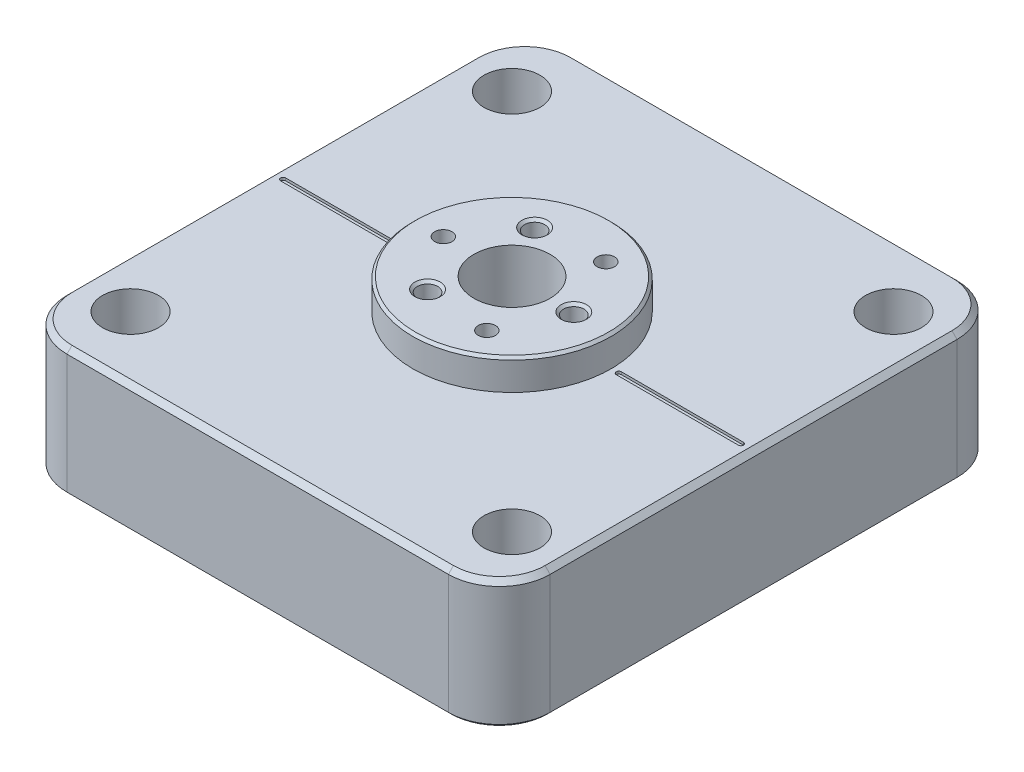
SolidWorks part; units mm, degrees
ref_plane "前视基准面" through (0, 0, 0) normal (0, 0, 1) x (1, 0, 0)
ref_plane "上视基准面" through (0, 0, 0) normal (0, 1, 0) x (1, 0, 0)
ref_plane "右视基准面" through (0, 0, 0) normal (1, 0, 0) x (0, 0, -1)
sketch "Sketch1" plane through (0, 0, 0) normal (0, 1, 0) x (1, 0, 0)
  line L1 (-47.5, -50) -> (47.5, -50)
  line L2 (-47.5, -50) -> (-47.5, 50)
  line L3 (-47.5, 50) -> (47.5, 50)
  line L4 (47.5, -50) -> (47.5, 50)
  line L5 (-47.5, -50) -> (47.5, 50) construction
  line L6 (-47.5, 50) -> (47.5, -50) construction
  point P0 (0, 0)
  dimension "D1" = 95
  dimension "D2" = 100
extrude "Extrude1" add sketch "Sketch1" along normal blind 25
fillet "Fillet1" radius 10 4 edges at (47.5, 12.5, 50) (-47.5, 12.5, -50) (47.5, 12.5, -50) (-47.5, 12.5, 50)
sketch "Sketch2" plane through (0, 25, 0) normal (0, 1, 0) x (1, 0, 0)
  circle A0 centre (0, 0) radius 19.5
  dimension "D1" = 39
extrude "Extrude2" add sketch "Sketch2" along normal blind 6
sketch "Sketch23" plane through (0, 25, 0) normal (0, -1, 0) x (-1, 0, 0)
  line L1 (37.5, -37.5) -> (-37.5, -37.5) construction
  line L2 (37.5, -37.5) -> (37.5, 37.5) construction
  line L3 (37.5, 37.5) -> (-37.5, 37.5) construction
  line L4 (-37.5, -37.5) -> (-37.5, 37.5) construction
  line L5 (37.5, -37.5) -> (-37.5, 37.5) construction
  line L6 (37.5, 37.5) -> (-37.5, -37.5) construction
  circle A0 centre (-37.5, 37.5) radius 3.25
  circle A1 centre (37.5, 37.5) radius 3.25
  circle A2 centre (37.5, -37.5) radius 3.25
  circle A3 centre (-37.5, -37.5) radius 3.25
  point P0 (0, 0)
  dimension "D2" = 6.5
  dimension "D1" = 75
hole_wizard "打孔尺寸(%根据)内六角圆柱头螺钉的类型2" positions "3D草图2" profile "草图5" counterbore size "M6" standard "GB"
sketch3d "3D草图2"
  point P0 (37.5, 25, -37.5)
  point P3 (37.5, 25, 37.5)
  point P6 (-37.5, 25, 37.5)
  point P9 (-37.5, 25, -37.5)
sketch "草图5" plane through (37.5, 25, -37.5) normal (1, 0, 0) x (0, 0, 1)
  line L0 (0, 0) -> (0, 31.9828)
  line L1 (0, 31.9828) -> (3.3, 30)
  line L2 (3.3, 30) -> (3.3, 17)
  line L3 (3.3, 17) -> (5.5, 17)
  line L4 (5.5, 17) -> (5.5, 0)
  line L5 (5.5, 0) -> (0, 0)
  line L10 (0, 31.9828) -> (-3.3, 30) construction
  line L11 (0, -6.35) -> (0, 107.95) construction
  dimension "孔直径" = 6.6
  dimension "孔深度" = 30
  dimension "柱形沉头孔直径" = 11
  dimension "柱形沉头孔深度" = 17
  dimension "导头角度" = 118
chamfer "Chamfer12" distance 1 angle 45 8 edges at (44.5711, 25, 47.0711) (47.5, 25, 0) (0, 25, 50) (44.5711, 25, -47.0711) (-44.5711, 25, 47.0711) (0, 25, -50) (-47.5, 25, 0) (-44.5711, 25, -47.0711)
sketch "Sketch34" plane through (0, 0, 0) normal (0, -1, 0) x (-1, 0, 0)
  line L0 (-37.5, 50) -> (37.5, 50) construction
  line L1 (32.5, -35) -> (-32.5, -35)
  line L2 (32.5, -35) -> (32.5, 35)
  line L3 (32.5, 35) -> (-32.5, 35)
  line L4 (-32.5, -35) -> (-32.5, 35)
  line L5 (32.5, -35) -> (-32.5, 35) construction
  line L6 (32.5, 35) -> (-32.5, -35) construction
  line L7 (-47.5, -40) -> (-47.5, 40) construction
  point P0 (0, 0)
  dimension "D1" = 15
  dimension "D2" = 15
extrude "Extrude20" cut sketch "Sketch34" against normal blind 17
fillet "Fillet12" radius 10 4 edges at (-32.5, 8.5, -35) (-32.5, 8.5, 35) (32.5, 8.5, 35) (32.5, 8.5, -35)
sketch "Sketch35" plane through (0, 17, 0) normal (0, 1, 0) x (1, 0, 0)
  line L0 (0, 0) -> (-13.5, 0) construction
  line L1 (0, 0) -> (-73.8178, 0) construction
  circle A0 centre (0, 0) radius 13.5 construction
  circle A1 centre (-13.5, 0) radius 1.75
  dimension "D1" = 27
  dimension "D2" = 3.5
  dimension "D3" = 0
hole_wizard "打孔尺寸(%根据)内六角圆柱头螺钉的类型2" positions "3D草图1" profile "草图2" counterbore size "M3" standard "GB"
sketch3d "3D草图1"
  point P0 (-13.5, 17, 0)
sketch "草图2" plane through (-13.5, 17, 0) normal (1, 0, 0) x (0, 0, -1)
  line L0 (0, 0) -> (0, 14)
  line L1 (0, 14) -> (1.7, 14)
  line L3 (1.7, 14) -> (1.7, 9)
  line L4 (1.7, 9) -> (3, 9)
  line L5 (3, 9) -> (3, 0)
  line L7 (3, 0) -> (0, 0)
  line L11 (0, -6.35) -> (0, 107.95) construction
  dimension "通孔孔直径" = 3.4
  dimension "通孔孔深度" = 14
  dimension "柱形沉头孔直径" = 6
  dimension "柱形沉头孔深度" = 9
pattern_circular "阵列(圆周)1" count 3 over 360 about axis through (0, 0, 0) along (0, 1, 0) of "打孔尺寸(%根据)内六角圆柱头螺钉的类型2"
sketch "草图1" plane through (0, 31, 0) normal (0, 1, 0) x (1, 0, 0)
  circle A0 centre (0, 0) radius 12.5
  dimension "D1" = 25
sketch "草图3" plane through (0, 25, 0) normal (0, 1, 0) x (1, 0, 0)
  line L0 (0, 0) -> (-26.717, 0) construction
  line L1 (-45, 0) -> (-21, 0) construction
  line L2 (-45, 0.5) -> (-21, 0.5)
  line L3 (-45, -0.5) -> (-21, -0.5)
  arc A0 (-45, 0.5) -> (-45, -0.5) centre (-45, 0) ccw
  arc A1 (-21, -0.5) -> (-21, 0.5) centre (-21, 0) ccw
  point P5 (-33, 0)
  dimension "D1" = 0.5
  dimension "D2" = 33
  dimension "D3" = 24
extrude "切除-拉伸1" cut sketch "草图3" against normal blind 0.5
mirror "镜向1" about plane through (0, 0, 0) normal (1, 0, 0) of "切除-拉伸1"
sketch "草图4" plane through (0, 17, 0) normal (0, -1, 0) x (-1, 0, 0)
  circle A0 centre (0, 0) radius 7.5
  dimension "D1" = 15
extrude "切除-拉伸2" cut sketch "草图4" against normal through all
chamfer "倒角2" distance 0.5 angle 45 8 edges at (0, 0, -35) (29.5711, 0, -32.0711) (-29.5711, 0, -32.0711) (32.5, 0, 0) (-32.5, 0, 0) (29.5711, 0, 32.0711) (-29.5711, 0, 32.0711) (0, 0, 35)
chamfer "倒角3" distance 0.5 angle 45 8 edges at (47.5, 0, 0) (44.5711, 0, -47.0711) (44.5711, 0, 47.0711) (0, 0, -50) (0, 0, 50) (-44.5711, 0, -47.0711) (-44.5711, 0, 47.0711) (-47.5, 0, 0)
sketch "草图6" plane through (0, 31, 0) normal (0, 1, 0) x (1, 0, 0)
  line L0 (0, 0) -> (12.15, 0) construction
  circle A0 centre (0, 0) radius 12.15 construction
  circle A1 centre (12.15, 0) radius 2
  dimension "D1" = 24.3
  dimension "D2" = 4
extrude "切除-拉伸3" cut sketch "草图6" against normal blind 6
pattern_circular "阵列(圆周)2" count 3 over 360 about axis through (0, 0, 0) along (0, 1, 0) of "切除-拉伸3"
chamfer "倒角4" distance 0.5 angle 45 3 edges at (-7.8071, 31, 9.5222) (12.15, 31, 2) (-4.3429, 31, -11.5222)
chamfer "倒角5" distance 0.5 angle 45 1 edges at (0, 31, 19.5)
